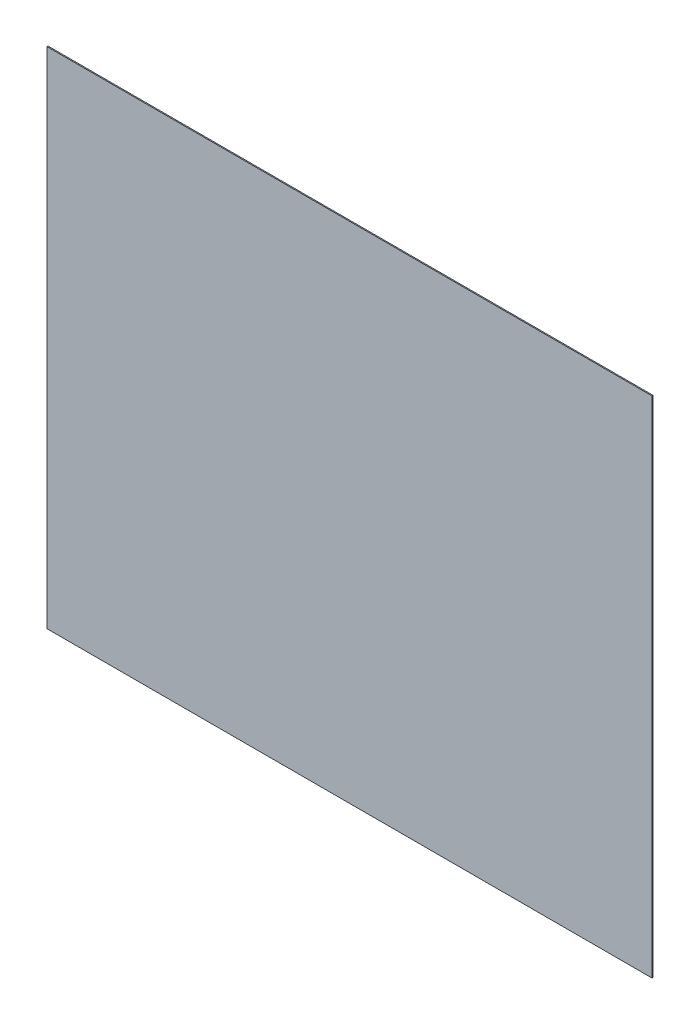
SolidWorks part; units mm, degrees
ref_plane "Front" through (0, 0, 0) normal (0, 0, 1) x (1, 0, 0)
ref_plane "Top" through (0, 0, 0) normal (0, 1, 0) x (1, 0, 0)
ref_plane "Right" through (0, 0, 0) normal (1, 0, 0) x (0, 0, -1)
sketch "Sketch1" plane through (0, 0, 0) normal (0, 0, 1) x (1, 0, 0)
  line L1 (-1828.8, 1524) -> (1828.8, 1524)
  line L2 (-1828.8, 1524) -> (-1828.8, -1524)
  line L3 (-1828.8, -1524) -> (1828.8, -1524)
  line L4 (1828.8, 1524) -> (1828.8, -1524)
  line L5 (-1828.8, 1524) -> (1828.8, -1524) construction
  line L6 (-1828.8, -1524) -> (1828.8, 1524) construction
  point P0 (0, 0)
  dimension "D1" = 3048
  dimension "D2" = 3657.6
extrude "Boss-Extrude1" add sketch "Sketch1" against normal blind 6.35
